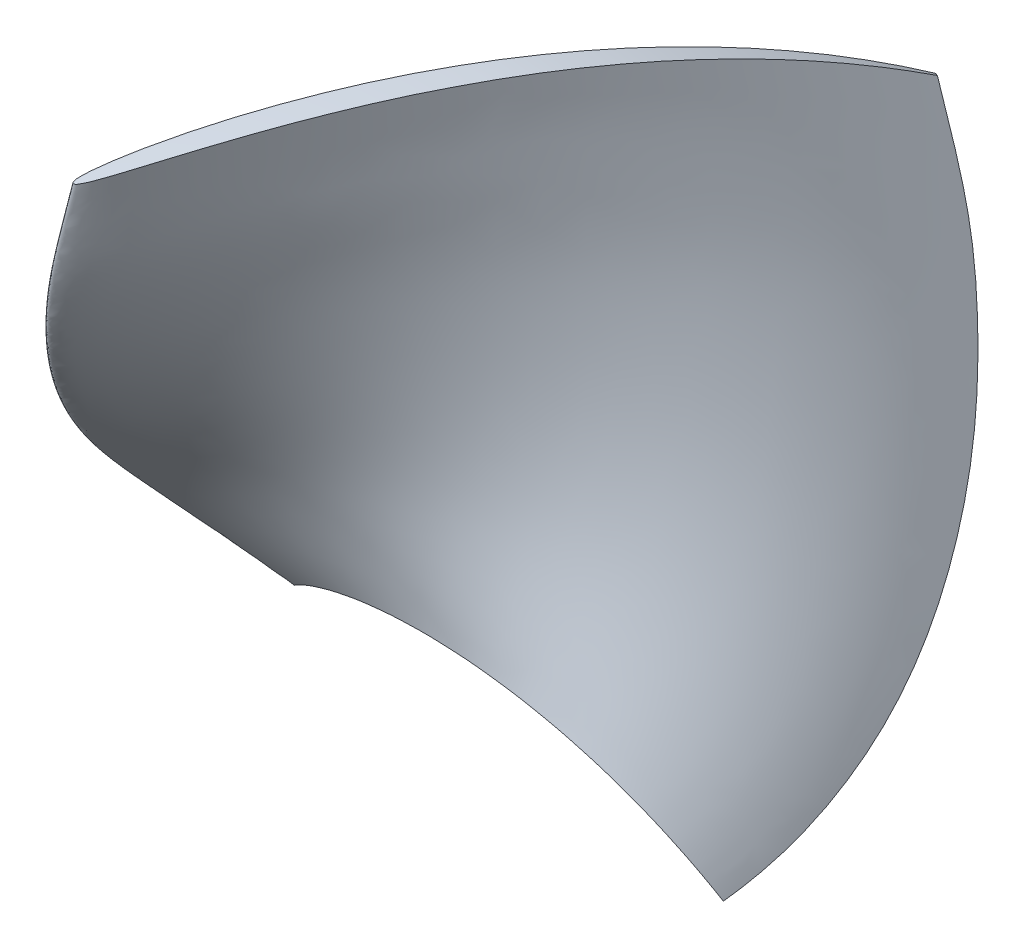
SolidWorks part; units mm, degrees
other "<SpiegelnKaplanfluegel>-<<Kaplanfluegel>-<Oberflächenausfüllung5>>"
ref_plane "Ebene vorne" through (0, 0, 0) normal (0, 0, 1) x (1, 0, 0)
ref_plane "Ebene oben" through (0, 0, 0) normal (0, 1, 0) x (1, 0, 0)
ref_plane "Ebene rechts" through (0, 0, 0) normal (1, 0, 0) x (0, 0, -1)
ref_plane "Ebene vorne-SpiegelnKaplanfluegel" through (0, 0, 0) normal (0, 0, 1) x (1, 0, 0)
ref_plane "Ebene oben-SpiegelnKaplanfluegel" through (0, 0, 0) normal (0, 1, 0) x (1, 0, 0)
ref_plane "Ebene rechts-SpiegelnKaplanfluegel" through (0, 0, 0) normal (1, 0, 0) x (0, 0, -1)
inserted part "SpiegelnKaplanfluegel"
move or copy body "Körper-Verschieben/Kopieren2"
scale "Skalieren1" scale about origin uniform scaling yes scale factor 1.5
sketch "Skizze1" plane through (0, 0, 0) normal (1, 0, 0) x (0, 0, -1)
  line L0 (295.804, 50) -> (-295.804, 50)
  line L1 (-427.3257, 0) -> (432.5058, 0) construction
  arc A0 (295.804, 50) -> (-295.804, 50) centre (0, 0) ccw
  dimension "D1" = 600
  dimension "D2" = 50
equation "\"Gesamtgewicht\"=\"SW-Masse\"/1000"
